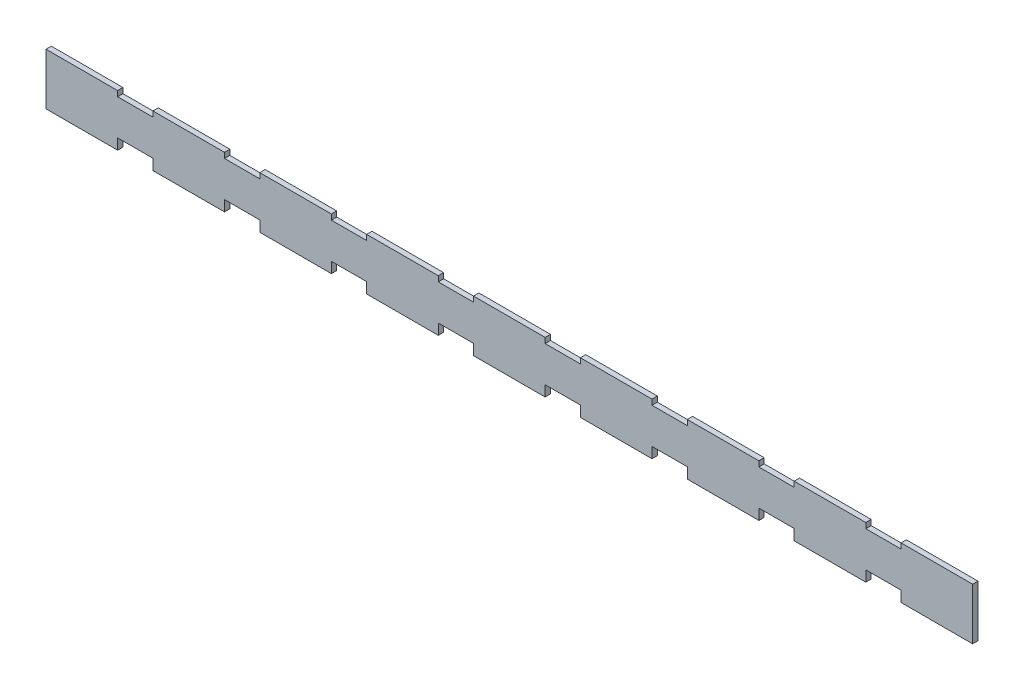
SolidWorks part; units mm, degrees
ref_plane "Front Plane" through (0, 0, 0) normal (0, 0, 1) x (1, 0, 0)
ref_plane "Top Plane" through (0, 0, 0) normal (0, 1, 0) x (1, 0, 0)
ref_plane "Right Plane" through (0, 0, 0) normal (1, 0, 0) x (0, 0, -1)
sketch "Sketch1" plane through (0, 0, 0) normal (0, 0, 1) x (1, 0, 0)
  line L5 (21, 12.5) -> (21, -12.5) construction
  line L6 (219.9, -10) -> (200.1, -10)
  line L98 (260.1, -10) -> (260.1, 10)
  line L100 (219.9, 10) -> (200.1, 10)
  line L101 (-260.1, -10) -> (-260.1, 10)
  line L102 (260.1, -10) -> (-260.1, 10) construction
  line L106 (260.1, 10) -> (-260.1, -10) construction
  line L108 (-260.1, -10) -> (-260.1, -16)
  line L109 (-260.1, -16) -> (-219.9, -16)
  line L111 (-219.9, -10) -> (-219.9, -16)
  line L112 (-200.1, -10) -> (-200.1, -16)
  line L114 (-159.9, -10) -> (-159.9, -16)
  line L116 (-200.1, -16) -> (-159.9, -16)
  line L119 (-140.1, -10) -> (-140.1, -16)
  line L121 (-99.9, -10) -> (-99.9, -16)
  line L122 (-140.1, -16) -> (-99.9, -16)
  line L123 (-80.1, -10) -> (-80.1, -16)
  line L125 (-39.9, -10) -> (-39.9, -16)
  line L126 (-80.1, -16) -> (-39.9, -16)
  line L127 (-20.1, -10) -> (-20.1, -16)
  line L129 (20.1, -10) -> (20.1, -16)
  line L130 (-20.1, -16) -> (20.1, -16)
  line L131 (39.9, -10) -> (39.9, -16)
  line L133 (80.1, -10) -> (80.1, -16)
  line L134 (39.9, -16) -> (80.1, -16)
  line L135 (99.9, -10) -> (99.9, -16)
  line L137 (140.1, -10) -> (140.1, -16)
  line L138 (99.9, -16) -> (140.1, -16)
  line L139 (159.9, -10) -> (159.9, -16)
  line L141 (200.1, -10) -> (200.1, -16)
  line L142 (159.9, -16) -> (200.1, -16)
  line L143 (219.9, -10) -> (219.9, -16)
  line L145 (260.1, -10) -> (260.1, -16)
  line L146 (219.9, -16) -> (260.1, -16)
  line L147 (-200.1, 10) -> (-200.1, 13)
  line L149 (-260.1, 10) -> (-260.1, 13)
  line L150 (-260.1, 13) -> (-219.9, 13)
  line L151 (-219.9, 10) -> (-219.9, 13)
  line L153 (-159.9, 10) -> (-159.9, 13)
  line L154 (-200.1, 13) -> (-159.9, 13)
  line L155 (-140.1, 10) -> (-140.1, 13)
  line L157 (-99.9, 10) -> (-99.9, 13)
  line L158 (-140.1, 13) -> (-99.9, 13)
  line L159 (-80.1, 10) -> (-80.1, 13)
  line L161 (-39.9, 10) -> (-39.9, 13)
  line L162 (-80.1, 13) -> (-39.9, 13)
  line L163 (-20.1, 10) -> (-20.1, 13)
  line L165 (20.1, 10) -> (20.1, 13)
  line L166 (-20.1, 13) -> (20.1, 13)
  line L167 (39.9, 10) -> (39.9, 13)
  line L169 (80.1, 10) -> (80.1, 13)
  line L170 (39.9, 13) -> (80.1, 13)
  line L171 (99.9, 10) -> (99.9, 13)
  line L173 (140.1, 10) -> (140.1, 13)
  line L174 (99.9, 13) -> (140.1, 13)
  line L175 (159.9, 10) -> (159.9, 13)
  line L177 (200.1, 10) -> (200.1, 13)
  line L178 (159.9, 13) -> (200.1, 13)
  line L179 (219.9, 10) -> (219.9, 13)
  line L181 (260.1, 10) -> (260.1, 13)
  line L182 (219.9, 13) -> (260.1, 13)
  line L183 (-200.1, -10) -> (-219.9, -10)
  line L184 (-200.1, 10) -> (-219.9, 10)
  line L185 (-140.1, -10) -> (-159.9, -10)
  line L186 (-140.1, 10) -> (-159.9, 10)
  line L187 (-80.1, 10) -> (-99.9, 10)
  line L188 (-80.1, -10) -> (-99.9, -10)
  line L189 (99.9, -10) -> (80.1, -10)
  line L190 (39.9, 10) -> (20.1, 10)
  line L191 (99.9, 10) -> (80.1, 10)
  line L192 (159.9, 10) -> (140.1, 10)
  line L193 (159.9, -10) -> (140.1, -10)
  line L194 (39.9, -10) -> (20.1, -10)
  line L195 (-20.1, -10) -> (-39.9, -10)
  line L196 (-20.1, 10) -> (-39.9, 10)
  point P0 (0, 0)
  point P1 (0, 0)
  dimension "D1" = 20
  dimension "D2" = 520.2
  dimension "D3" = 6
  dimension "D4" = 40.2
  dimension "D5" = 9
  dimension "D7" = 9
  dimension "D8" = 40.2
  dimension "D6" = 3
extrude "Boss-Extrude1" add sketch "Sketch1" along normal blind 3
